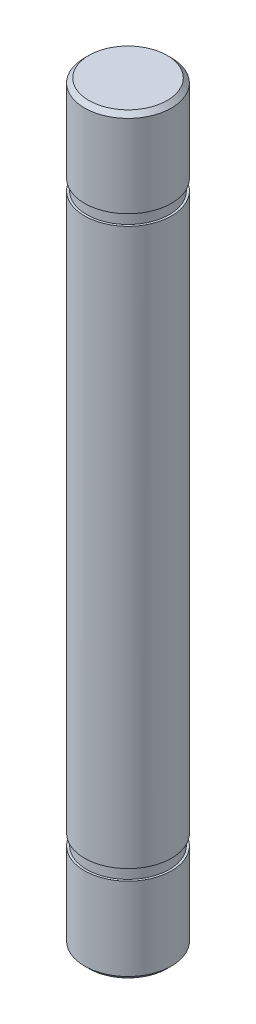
SolidWorks part; units mm, degrees
ref_plane "Front" through (0, 0, 0) normal (0, 0, 1) x (1, 0, 0)
ref_plane "Top" through (0, 0, 0) normal (0, 1, 0) x (1, 0, 0)
ref_plane "Right" through (0, 0, 0) normal (1, 0, 0) x (0, 0, -1)
sketch "Sketch1" plane through (0, 0, 0) normal (0, 0, 1) x (1, 0, 0)
  line L0 (0, 0) -> (0, 64.9865) construction
  line L2 (0, 0) -> (2, 0)
  line L3 (0, 0) -> (0, 34.6)
  line L4 (0, 34.6) -> (2, 34.6)
  line L5 (2, 0) -> (2, 34.6)
  dimension "D1" = 2
  dimension "D2" = 34.6
revolve "Revolve1" add sketch "Sketch1" angle 360 about L0
chamfer "Chamfer1" distance 0.2 angle 45 2 edges at (0, 0, -2) (0, 34.6, -2)
sketch "Sketch2" plane through (0, 0, 0) normal (0, 0, 1) x (1, 0, 0)
  line L0 (0, 0) -> (0, 4.735) construction
  line L1 (2, 0.2) -> (2, 34.4) construction
  line L2 (2, 4.5) -> (1.9, 4.5)
  line L3 (2, 4.5) -> (2, 4)
  line L4 (2, 4) -> (1.9, 4)
  line L5 (1.9, 4.5) -> (1.9, 4)
  line L6 (-1.8, 0) -> (1.8, 0) construction
  dimension "D1" = 3.8
  dimension "D2" = 0.5
  dimension "D3" = 4
revolve "Cut-Revolve1" cut sketch "Sketch2" angle 360 about L0
sketch "Sketch3" plane through (0, 0, 0) normal (0, 0, 1) x (1, 0, 0)
  line L0 (0, 43.6541) -> (0, 31.6949) construction
  line L1 (2, 4.5) -> (2, 34.4) construction
  line L2 (2, 30.6) -> (1.9, 30.6)
  line L3 (2, 30.6) -> (2, 30.1)
  line L4 (2, 30.1) -> (1.9, 30.1)
  line L5 (1.9, 30.6) -> (1.9, 30.1)
  line L6 (2.65, 30.1) -> (-2.65, 30.1) construction
  line L7 (1.9, 4) -> (1.9, 4.5) construction
  dimension "D1" = 0.5
revolve "Cut-Revolve2" cut sketch "Sketch3" angle 360 about L0
